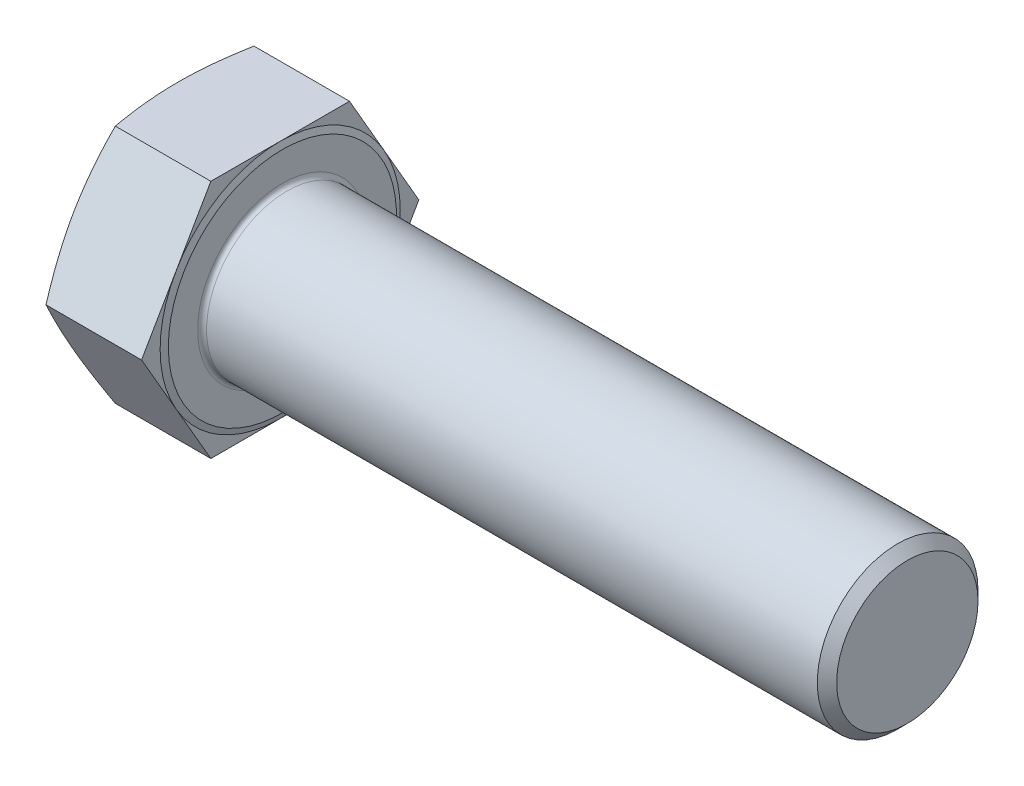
SolidWorks part; units mm, degrees
ref_plane "Front" through (0, 0, 0) normal (0, 0, 1) x (1, 0, 0)
ref_plane "Top" through (0, 0, 0) normal (0, 1, 0) x (1, 0, 0)
ref_plane "Right" through (0, 0, 0) normal (1, 0, 0) x (0, 0, -1)
sketch "Sketch-BaseHead" plane through (0, 0, 0) normal (1, 0, 0) x (0, 0, -1)
  line L1 (31.0614, 0) -> (15.5307, 26.9)
  line L2 (15.5307, 26.9) -> (-15.5307, 26.9)
  line L3 (-15.5307, 26.9) -> (-31.0614, 0)
  line L4 (-31.0614, 0) -> (-15.5307, -26.9)
  line L5 (-15.5307, -26.9) -> (15.5307, -26.9)
  line L6 (15.5307, -26.9) -> (31.0614, 0)
  circle A0 centre (0, 0) radius 26.9 construction
  dimension "s" = 53.8
extrude "BaseHead" add sketch "Sketch-BaseHead" along normal blind 22.92
sketch "Sketch4" plane through (-0.2646, 0, 5.9169) normal (0, 1, 0) x (0, 0, -1)
  line L0 (5.9169, 3.7369) -> (5.9169, -10.4477) construction
  line L2 (36.9783, -0.2646) -> (32.8169, -0.2646)
  line L4 (32.8169, -0.2646) -> (36.9783, -1.7793)
  line L6 (36.9783, -1.7793) -> (36.9783, -0.2646)
  dimension "D1" = 20
  dimension "D2" = 53.8
revolve "HeadChamfer" cut sketch "Sketch4" angle 360 about L0
sketch "Sketch1" plane through (0, 0, 0) normal (0, 0, 1) x (1, 0, 0)
  line L0 (22.92, 0) -> (23.42, 0)
  line L1 (23.42, 0) -> (23.42, -25.555)
  line L2 (23.42, -25.555) -> (22.92, -26.9)
  line L3 (22.92, -26.9) -> (22.92, 0) construction
  line L4 (0, 0) -> (7.5821, 0) construction
  line L5 (-4.0016, 0) -> (10.1831, 0) construction
  line L6 (22.92, -26.9) -> (1.5146, -26.9) construction
  line L7 (22.92, 0) -> (22.92, -26.9)
  dimension "D1" = 26.9
  dimension "c" = 0.5
  dimension "D2" = 25.555
revolve "Revolve1" add sketch "Sketch1" angle 360 about axis through (-4.0016, 0, 0) along (1, 0, 0)
ref_plane "Plane2" through (79.42, 0, 0) normal (1, 0, 0) x (0, 0, -1)
sketch "Sketch3" plane through (23.42, 0, 0) normal (1, 0, 0) x (0, 0, -1)
  circle A0 centre (0, 0) radius 18
  dimension "d" = 36
extrude "BaseBody" add sketch "Sketch3" along normal blind 140
fillet "HeadFillet" radius 1 1 edges at (23.42, 0, -18)
chamfer "Chamfer1" distance 2.165 angle 45 1 edges at (163.42, 0, -18)
equation "\"D1@Sketch1\" = \"s@Sketch-BaseHead\"/ 2"
equation "\"D2@Sketch4\" = \"s@Sketch-BaseHead\""
equation "\"D1@Chamfer1\" =  ( \"d@Sketch3\" - \"D2@ThreadCosmetic1\" ) / 2 "
equation "\"b@ThreadCosmetic1\" = \"l@BaseBody\" - \"lg@Plane2\""
